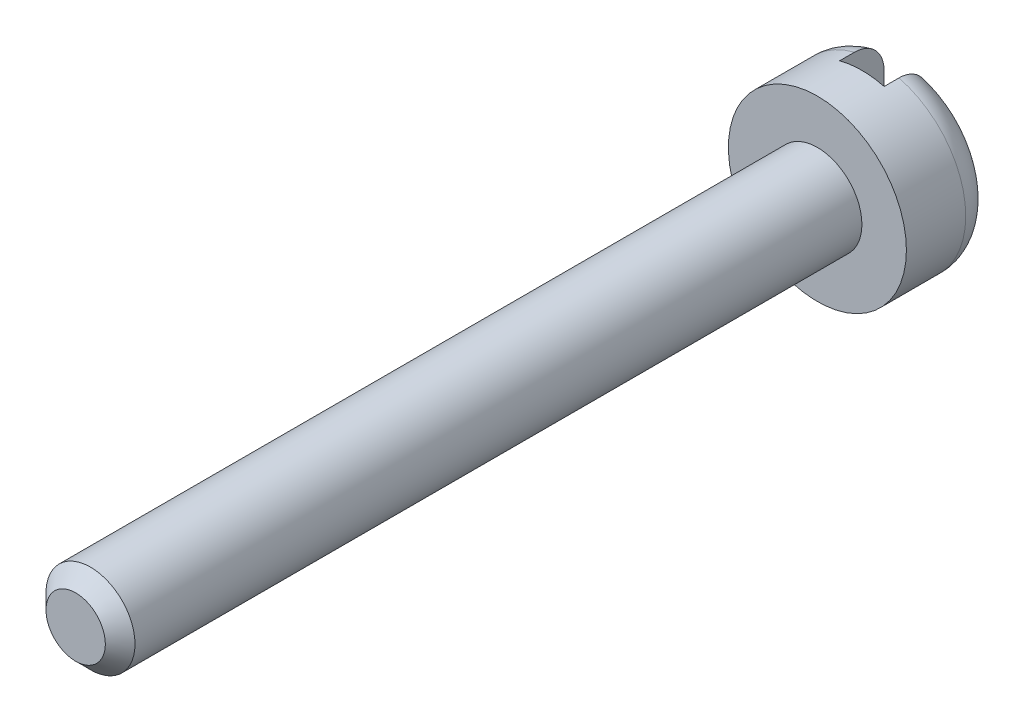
SolidWorks part; units mm, degrees
ref_plane "Plane1" through (0, 0, 0) normal (0, 0, 1) x (1, 0, 0)
ref_plane "Plane2" through (0, 0, 0) normal (0, 1, 0) x (1, 0, 0)
ref_plane "Plane3" through (0, 0, 0) normal (1, 0, 0) x (0, 0, -1)
sketch "Esquisse1" plane through (0, 0, 0) normal (0, 0, 1) x (1, 0, 0)
  circle A0 centre (0, 0) radius 3
  dimension "D1" = 6
extrude "Base-Extrusion" add sketch "Esquisse1" along normal blind 3
sketch "Esquisse2" plane through (0, 0, 0) normal (0, 1, 0) x (1, 0, 0)
  line L0 (-0.75, 0) -> (0.75, 0)
  line L1 (-0.75, 0) -> (-0.75, -1.5)
  line L2 (0.75, -1.5) -> (-0.75, -1.5)
  line L3 (0.75, -1.5) -> (0.75, 0)
  line L4 (3, 0) -> (-3, 0) construction
  line L5 (0, -53) -> (0, 47) construction
  dimension "D1" = 1.5
  dimension "D2" = 1.5
  dimension "D3" = 1.5
  dimension "D4" = 0.75
extrude "Enlèv. mat.-Extru.1" cut sketch "Esquisse2" against normal blind 23
sketch "Esquisse3" plane through (0, 0, 0) normal (0, -1, 0) x (1, 0, 0)
  line L0 (0.75, 1.5) -> (-0.75, 1.5)
  line L1 (0.75, 1.5) -> (0.75, 0)
  line L2 (-0.75, 0) -> (0.75, 0)
  line L3 (-0.75, 0) -> (-0.75, 1.5)
extrude "Enlèv. mat.-Extru.2" cut sketch "Esquisse3" against normal blind 23
sketch "Esquisse4" plane through (0, 0, 3) normal (0, 0, 1) x (1, 0, 0)
  circle A0 centre (0, 0) radius 1.5
  dimension "D1" = 3
extrude "Boss.-Extru.1" add sketch "Esquisse4" along normal blind 25
chamfer "Chanfrein1" distance 0.5 angle 45
fillet "Congé1" radius 1
